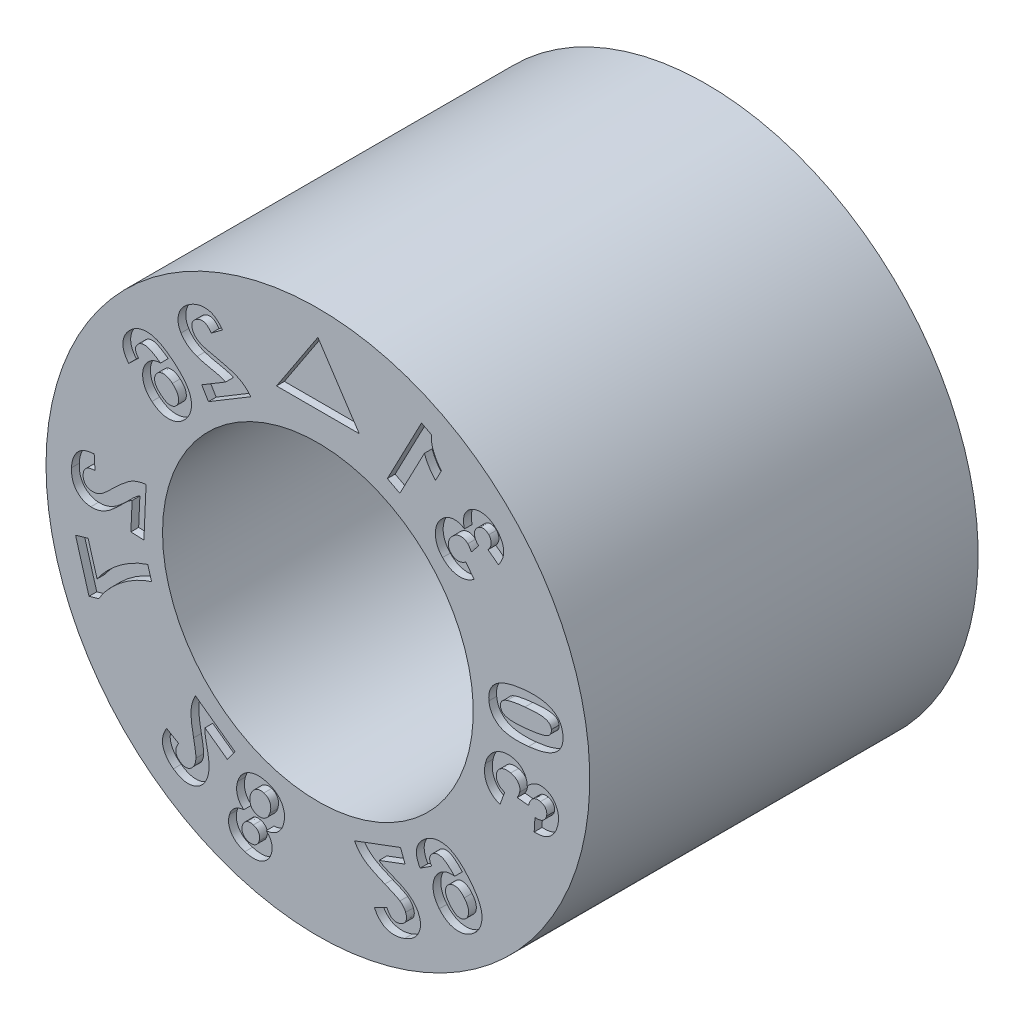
SolidWorks part; units mm, degrees
ref_plane "Front Plane" through (0, 0, 0) normal (0, 0, 1) x (1, 0, 0)
ref_plane "Top Plane" through (0, 0, 0) normal (0, 1, 0) x (1, 0, 0)
ref_plane "Right Plane" through (0, 0, 0) normal (1, 0, 0) x (0, 0, -1)
imported_body "Imported1"
other "Move Face1" parameters "D1"=0.22
other "DeleteFace2"
sketch "Sketch1" plane through (0, 0, 0) normal (0, 0, 1) x (1, 0, 0)
  arc A0 (-0.8358, 2.0974) -> (0.9668, 2.0403) centre (0, 0) ccw construction
  text T2 "26  27  28  29  30  31" font "Arial" height 0.95
extrude "Cut-Extrude1" cut sketch "Sketch1" against normal blind 0.1
